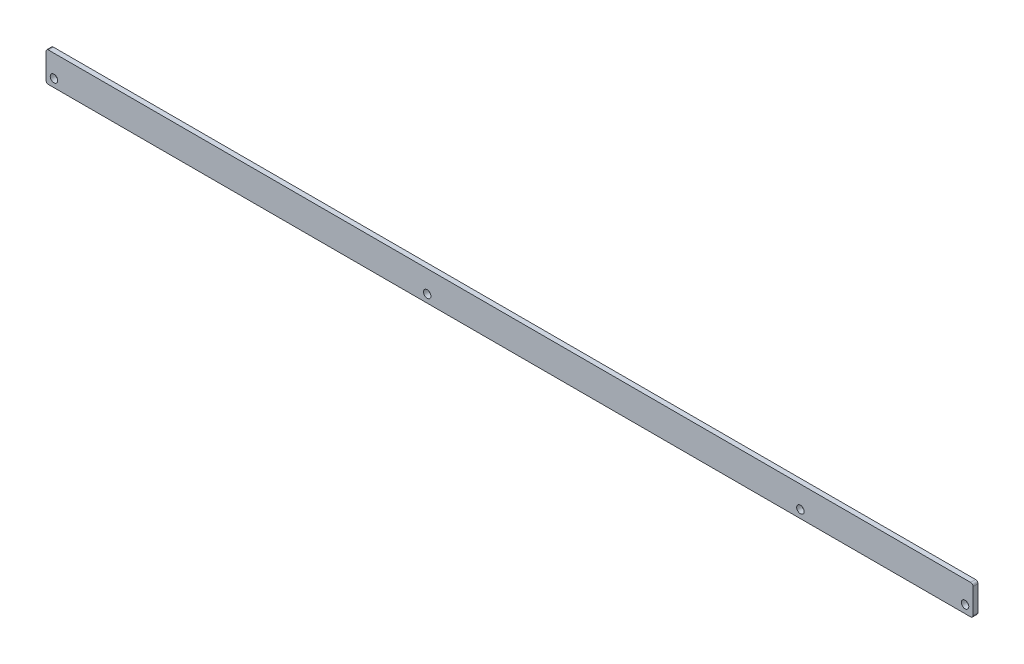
SolidWorks part; units mm, degrees
ref_plane "Front" through (0, 0, 0) normal (0, 0, 1) x (1, 0, 0)
ref_plane "Top" through (0, 0, 0) normal (0, 1, 0) x (1, 0, 0)
ref_plane "Right" through (0, 0, 0) normal (1, 0, 0) x (0, 0, -1)
sketch "Sketch1" plane through (0, 0, 0) normal (0, 0, 1) x (1, 0, 0)
  line L0 (-1196.34, -180.975) -> (-745.49, -180.975) construction
  line L1 (-1195.8882, -200.025) -> (-608.3862, -200.025)
  line L2 (-1197.4122, -198.501) -> (-1197.4122, -182.499)
  line L3 (-1195.8882, -180.975) -> (-608.3862, -180.975)
  line L4 (-606.8622, -198.501) -> (-606.8622, -182.499)
  line L5 (-1198.6822, -198.501) -> (-1198.6822, -21.844) construction
  arc A0 (-608.3862, -200.025) -> (-606.8622, -198.501) centre (-608.3862, -198.501) ccw
  arc A1 (-1197.4122, -182.499) -> (-1195.8882, -180.975) centre (-1195.8882, -182.499) cw
  arc A2 (-608.3862, -180.975) -> (-606.8622, -182.499) centre (-608.3862, -182.499) cw
  arc A3 (-1195.8882, -200.025) -> (-1197.4122, -198.501) centre (-1195.8882, -198.501) cw
  point P11 (-606.8622, -200.025)
  point P18 (-1197.4122, -200.025)
  dimension "D4" = 1.524
  dimension "D1" = 1.27
  dimension "D2" = 19.05
  dimension "D3" = 590.55
extrude "Boss-Extrude1" add sketch "Sketch1" along normal blind 3.175 separate body
hole_wizard "Hole1" positions "Point_Sketch" profile "Profil_Sketch" hole size "Ø0.15" standard "ISO"
sketch "Point_Sketch" plane through (-1195.9865, -184.3439, 3.175) normal (0, 0, -1) x (1, 0, 0)
  point P0 (3.6543, 10.6011)
  point P2 (584.0443, 10.6011)
  point P4 (479.1565, 10.6011)
  point P6 (241.4054, 10.6011)
sketch "Profil_Sketch" plane through (-1192.3322, -194.945, 3.175) normal (1, 0, 0) x (0, -1, 0)
  line L0 (0, 0) -> (0, 3.175)
  line L1 (0, 3.175) -> (2.3812, 3.175)
  line L2 (2.3812, 3.175) -> (2.3813, 0)
  line L5 (2.3813, 0) -> (0, 0)
  line L11 (0, -6.35) -> (0, 107.95) construction
  dimension "Diameter" = 4.7625
  dimension "Thru Hole Depth" = 3.175
other "usin_DL090_8-32x.375-BHCS<1>"
